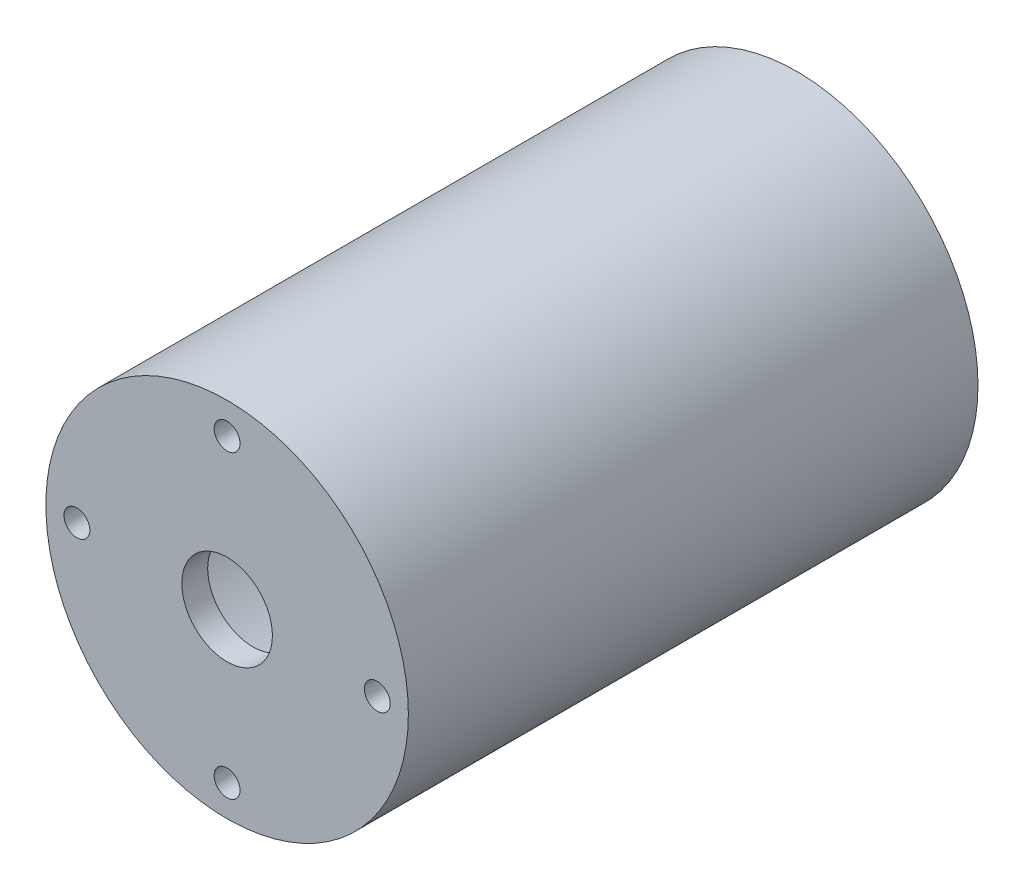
SolidWorks part; units mm, degrees
ref_plane "Alzado" through (0, 0, 0) normal (0, 0, 1) x (1, 0, 0)
ref_plane "Planta" through (0, 0, 0) normal (0, 1, 0) x (1, 0, 0)
ref_plane "Vista lateral" through (0, 0, 0) normal (1, 0, 0) x (0, 0, -1)
sketch "Croquis1" plane through (0, 0, 0) normal (0, 0, 1) x (1, 0, 0)
  circle A0 centre (0, 0) radius 70
  dimension "D1" = 140
extrude "Saliente-Extruir1" add sketch "Croquis1" along normal blind 220
sketch "Croquis2" plane through (0, 0, 0) normal (0, 0, -1) x (-1, 0, 0)
  circle A0 centre (0, 0) radius 65
  dimension "D1" = 130
extrude "Cortar-Extruir1" cut sketch "Croquis2" against normal blind 210
sketch "Croquis3" plane through (0, 0, 220) normal (0, 0, 1) x (1, 0, 0)
  circle A0 centre (0, 58) radius 5
  circle A1 centre (58, 0) radius 5
  circle A2 centre (0, -58) radius 5
  circle A3 centre (-58, 0) radius 5
  dimension "D2" = 10
  dimension "D1" = 58
  dimension "D3" = 4
extrude "Cortar-Extruir2" cut sketch "Croquis3" against normal up to next
sketch "Croquis4" plane through (0, 0, 220) normal (0, 0, 1) x (1, 0, 0)
  circle A0 centre (0, 0) radius 17.5
  dimension "D1" = 35
extrude "Cortar-Extruir3" cut sketch "Croquis4" against normal up to next
